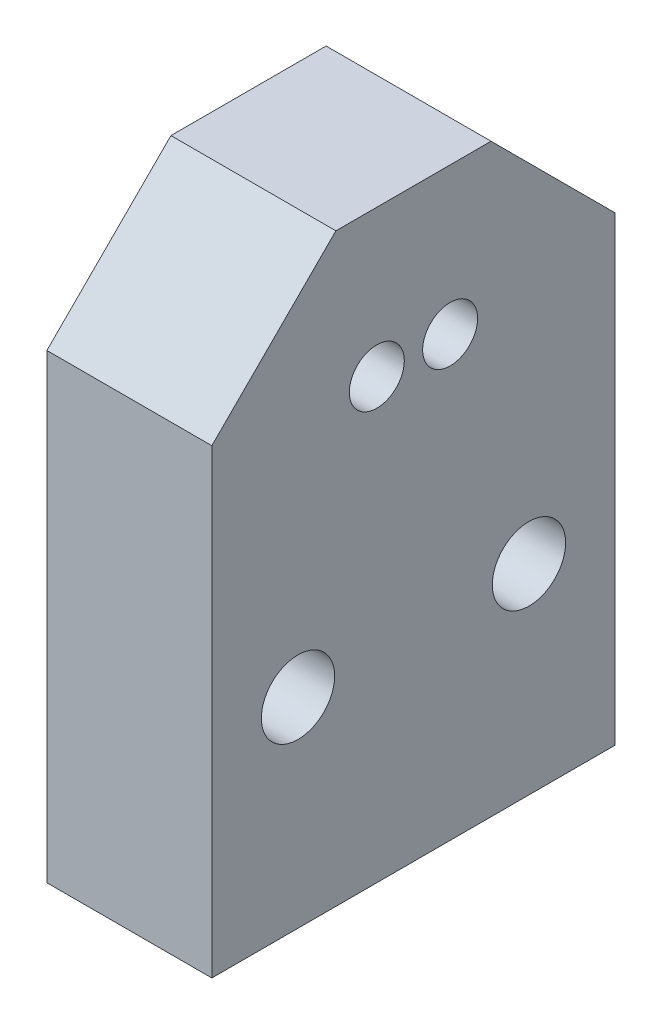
SolidWorks part; units mm, degrees
ref_plane "Front Plane" through (0, 0, 0) normal (0, 0, 1) x (1, 0, 0)
ref_plane "Top Plane" through (0, 0, 0) normal (0, 1, 0) x (1, 0, 0)
ref_plane "Right Plane" through (0, 0, 0) normal (1, 0, 0) x (0, 0, -1)
sketch "Sketch1" plane through (0, 0, 0) normal (1, 0, 0) x (0, 0, -1)
  line L2 (-19.0815, 35.7715) -> (-9.853, 45)
  line L3 (-9.853, 45) -> (-1.3866, 45)
  line L4 (-1.3866, 45) -> (7.8418, 35.7715)
  line L6 (-19.0815, 35.7715) -> (-19.0815, 13.0799)
  line L7 (7.8418, 35.7715) -> (7.8418, 13.0799)
  line L8 (-19.0815, 13.0799) -> (7.8418, 13.0799)
  dimension "D8" = 135
  dimension "D9" = 135
extrude "Boss-Extrude1" add sketch "Sketch1" along normal blind 9
sketch "Sketch2" plane through (9, 0, 0) normal (1, 0, 0) x (0, 0, -1)
  line L0 (-9.853, 45) -> (-9.853, 15.0715) construction
  line L1 (-1.3866, 45) -> (-1.3866, 15.0715) construction
  line L5 (-1.3866, 45) -> (-9.853, 45) construction
  circle A0 centre (-7.6198, 37) radius 1.5
  circle A1 centre (-3.6198, 37) radius 1.5
  circle A2 centre (-11.9198, 24) radius 2
  circle A3 centre (0.6802, 24) radius 2
  point P12 (-1.3866, 45)
  dimension "D1" = 3
  dimension "D2" = 3
  dimension "D5" = 8
  dimension "D3" = 4
  dimension "D4" = 4
  dimension "D10" = 21
  dimension "D11" = 13
  dimension "9.5" = 8
extrude "Cut-Extrude2" cut sketch "Sketch2" against normal through all contours A3 | A0 | A1 | A2
sketch "Sketch4" plane through (9, 0, 0) normal (1, 0, 0) x (0, 0, -1)
  line L0 (-16.6215, 38.2315) -> (-16.6215, 13.0799)
  line L1 (-9.853, 45) -> (-19.0815, 35.7715) construction
  line L2 (-19.0815, 13.0799) -> (7.8418, 13.0799) construction
  line L3 (5.3818, 38.2315) -> (5.3818, 13.0799)
  line L4 (7.8418, 35.7715) -> (-1.3866, 45) construction
  line L5 (-19.0815, 35.7715) -> (-19.0815, 13.0799) construction
  line L6 (7.8418, 13.0799) -> (7.8418, 35.7715) construction
  line L7 (-16.6215, 38.2315) -> (-21.8744, 38.2315)
  line L8 (-21.8744, 38.2315) -> (-21.8744, 12.7452)
  line L9 (-21.8744, 12.7452) -> (-16.6215, 12.7452)
  line L10 (-16.6215, 12.7452) -> (-16.6215, 13.0799)
  line L11 (5.3818, 38.2315) -> (11.9608, 38.2315)
  line L12 (11.9608, 38.2315) -> (11.9608, 12.3835)
  line L13 (11.9608, 12.3835) -> (5.3818, 12.3835)
  line L14 (5.3818, 12.3835) -> (5.3818, 13.0799)
  dimension "D1" = 2.46
  dimension "D2" = 2.46
extrude "Cut-Extrude3" cut sketch "Sketch4" against normal through all
